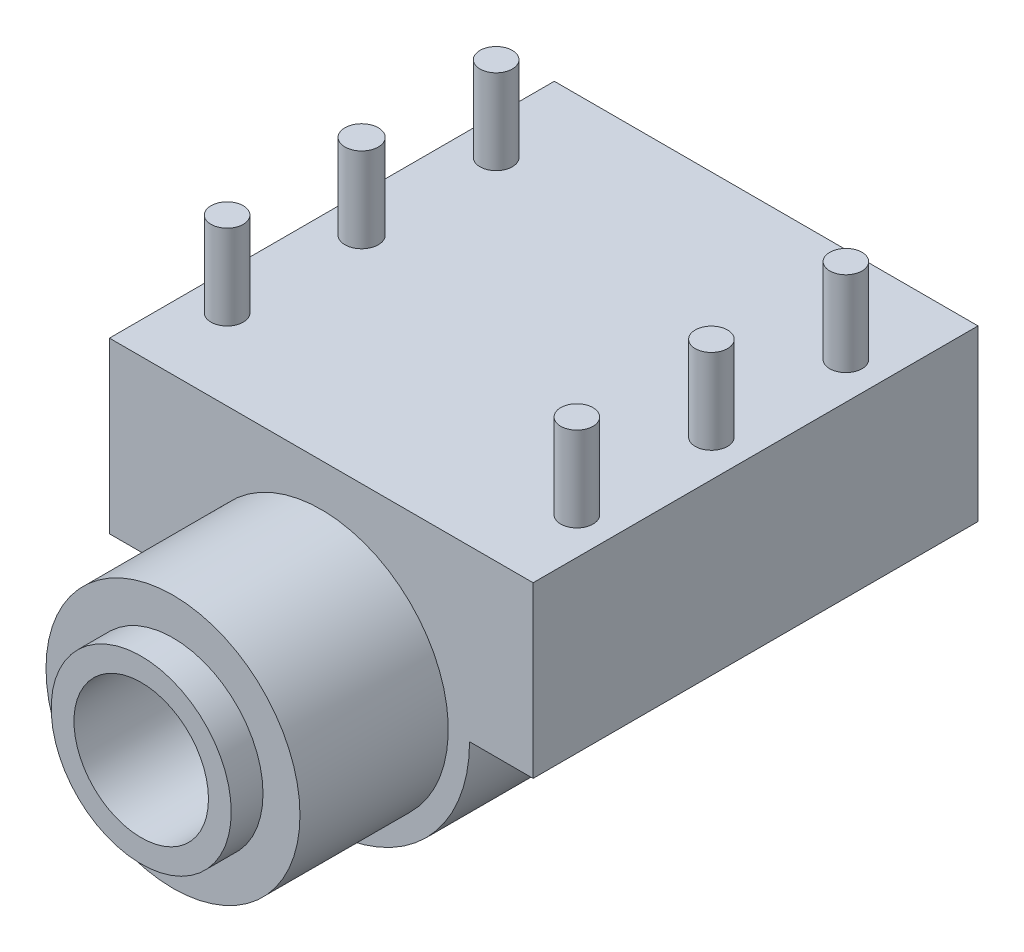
SolidWorks part; units mm, degrees
ref_plane "Спереди" through (0, 0, 0) normal (0, 0, 1) x (1, 0, 0)
ref_plane "Сверху" through (0, 0, 0) normal (0, 1, 0) x (1, 0, 0)
ref_plane "Справа" through (0, 0, 0) normal (1, 0, 0) x (0, 0, -1)
sketch "Эскиз1" plane through (0, 0, 0) normal (0, 0, 1) x (1, 0, 0)
  circle A0 centre (0, 0) radius 5.9944
extrude "Бобышка-Вытянуть1" add sketch "Эскиз1" along normal blind 7
sketch "Эскиз2" plane through (0, 0, 0) normal (0, 0, -1) x (-1, 0, 0)
  circle A0 centre (0, 0) radius 7
extrude "Бобышка-Вытянуть2" add sketch "Эскиз2" along normal blind 21
sketch "Эскиз3" plane through (0, 0, 0) normal (0, 0, 1) x (1, 0, 0)
  line L1 (10, 0) -> (-10, 0)
  line L2 (10, 0) -> (10, 8)
  line L3 (10, 8) -> (-10, 8)
  line L4 (-10, 0) -> (-10, 8)
extrude "Бобышка-Вытянуть4" add sketch "Эскиз3" against normal blind 21
sketch "Эскиз5" plane through (0, 8, 0) normal (0, 1, 0) x (1, 0, 0)
  circle A0 centre (-8.255, 16.51) radius 0.762
  circle A1 centre (8.255, 16.51) radius 0.762
  circle A2 centre (-8.255, 10.16) radius 0.7874
  circle A3 centre (8.255, 10.16) radius 0.762
  circle A4 centre (-8.255, 3.81) radius 0.762
  circle A5 centre (8.255, 3.81) radius 0.762
extrude "Бобышка-Вытянуть5" add sketch "Эскиз5" along normal blind 4
sketch "Sketch1" plane through (0, 0, -21) normal (0, 0, -1) x (-1, 0, 0)
  circle A0 centre (0, 0) radius 4.5
extrude "Boss-Extrude1" add sketch "Sketch1" along normal blind 3
chamfer "Chamfer1" distance 0.3 angle 85 1 edges at (-4.5, 0, -24)
sketch "Sketch2" plane through (0, 0, 7) normal (0, 0, 1) x (1, 0, 0)
  circle A0 centre (0, 0) radius 4.25
extrude "Boss-Extrude2" add sketch "Sketch2" along normal blind 1.5
sketch "Sketch3" plane through (0, 0, 8.5) normal (0, 0, 1) x (1, 0, 0)
  circle A0 centre (0, 0) radius 3.175
extrude "Cut-Extrude1" cut sketch "Sketch3" against normal blind 32
